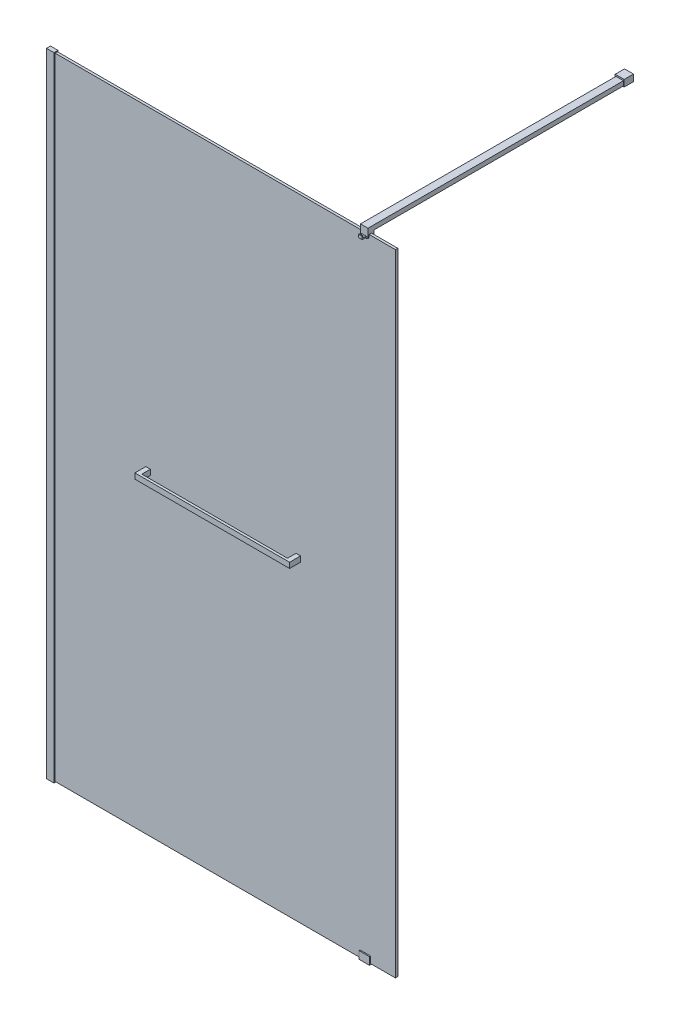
SolidWorks part; units mm, degrees
ref_plane "Płaszczyzna przednia" through (0, 0, 0) normal (0, 0, 1) x (1, 0, 0)
ref_plane "Płaszczyzna górna" through (0, 0, 0) normal (0, 1, 0) x (1, 0, 0)
ref_plane "Płaszczyzna prawa" through (0, 0, 0) normal (1, 0, 0) x (0, 0, -1)
sketch "Szkic1" plane through (0, 0, 0) normal (0, 1, 0) x (1, 0, 0)
  line L0 (0, 0) -> (0, 13.3)
  line L2 (0, 13.3) -> (25, 13.3)
  line L3 (25, 13.3) -> (25, 11.4)
  line L4 (25, 11.4) -> (11.45, 11.4)
  line L5 (11.45, 11.4) -> (11.45, 3.4)
  line L6 (11.45, 3.4) -> (25, 3.4)
  line L7 (25, 3.4) -> (25, 0)
  line L8 (25, 0) -> (0, 0)
  dimension "D1" = 13.3
  dimension "D4" = 1.9
  dimension "D5" = 8
  dimension "D6" = 3.4
  dimension "D7" = 13.55
  dimension "D8" = 25
extrude "Dodanie-wyciągnięcie1" add sketch "Szkic1" along normal blind 2100
sketch "Szkic2" plane through (0, 0, 0) normal (0, -1, 0) x (1, 0, 0)
  line L0 (11.45, -3.4) -> (1158.45, -3.4)
  line L1 (11.45, -3.4) -> (11.45, -11.4)
  line L2 (1158.45, -3.4) -> (1158.45, -11.4)
  line L3 (11.45, -11.4) -> (1158.45, -11.4)
  line L4 (11.45, -11.4) -> (25, -11.4) construction
  dimension "D1" = 1147
extrude "Dodanie-wyciągnięcie2" add sketch "Szkic2" against normal blind 2100 separate body
sketch "Szkic4" plane through (0, 2100, 0) normal (0, 1, 0) x (1, 0, 0)
  line L1 (25, 13.3) -> (0, 13.3) construction
  line L2 (25, 11.4) -> (25, 13.3) construction
  line L3 (0, 13.3) -> (0, 0) construction
  line L5 (0, 0) -> (25, 0) construction
  line L7 (25, 13.3) -> (0, 13.3)
  line L8 (25, 0) -> (25, 13.3)
  line L9 (0, 13.3) -> (0, 0)
  line L11 (0, 0) -> (25, 0)
extrude "Dodanie-wyciągnięcie3" add sketch "Szkic4" along normal blind 3
sketch "Szkic5" plane through (0, 0, 0) normal (0, -1, 0) x (1, 0, 0)
  line L1 (0, 0) -> (25, 0) construction
  line L2 (25, 0) -> (25, -3.4) construction
  line L3 (0, -13.3) -> (0, 0) construction
  line L5 (25, -13.3) -> (0, -13.3) construction
  line L7 (0, 0) -> (25, 0)
  line L8 (25, 0) -> (25, -13.3)
  line L9 (0, -13.3) -> (0, 0)
  line L11 (25, -13.3) -> (0, -13.3)
extrude "Dodanie-wyciągnięcie4" add sketch "Szkic5" along normal blind 3
ref_plane "Płaszczyzna1" through (1058.45, 0, 0) normal (1, 0, 0) x (0, 0, -1)
sketch "Szkic6" plane through (1058.45, 0, 0) normal (1, 0, 0) x (0, 0, -1)
  line L0 (11.4, 22) -> (15.75, 22)
  line L1 (15.75, 22) -> (15.75, -3)
  line L2 (15.75, -3) -> (-0.35, -3)
  line L3 (-0.35, -3) -> (-0.35, 22)
  line L4 (-0.35, 22) -> (3.4, 22)
  line L5 (11.4, 22) -> (11.4, 0)
  line L6 (11.4, 0) -> (11.4, 2100)
  line L7 (11.4, 0) -> (11.4, 2100) construction
  line L8 (3.4, 2100) -> (3.4, 0)
  line L9 (3.4, 2100) -> (3.4, 0) construction
  line L10 (11.4, 0) -> (3.4, 0)
  line L11 (3.4, 0) -> (3.4, 22)
  dimension "D1" = 4.35
  dimension "D2" = 25
  dimension "D3" = 3
  dimension "D4" = 3.75
extrude "Dodanie-wyciągnięcie5" add sketch "Szkic6" along normal mid plane 35 separate body
sketch "Szkic7" plane through (1058.45, 0, 0) normal (1, 0, 0) x (0, 0, -1)
  line L0 (3.4, 2100) -> (3.4, 0) construction
  line L1 (-0.6, 2120) -> (19.4, 2120)
  line L2 (3.4, 2100) -> (3.4, 0) construction
  line L4 (11.4, 2100) -> (3.4, 2100) construction
  line L13 (11.4, 2100) -> (11.4, 0) construction
  line L20 (19.4, 2120) -> (19.4, 2090)
  line L25 (19.4, 2090) -> (11.4, 2090)
  line L26 (11.4, 2090) -> (11.4, 2100)
  line L27 (11.4, 2100) -> (3.4, 2100)
  line L28 (3.4, 2100) -> (3.4, 2090)
  line L29 (3.4, 2090) -> (-13.37, 2090)
  line L30 (-13.37, 2090) -> (-13.37, 2100)
  line L31 (-13.37, 2100) -> (-10.37, 2100)
  line L32 (-10.37, 2100) -> (-9.8451, 2094)
  line L33 (-9.8451, 2094) -> (-0.6, 2094)
  line L34 (-0.6, 2094) -> (-0.6, 2120)
  dimension "D3" = 20
  dimension "D4" = 30
  dimension "D5" = 16.77
  dimension "D6" = 4
  dimension "D14" = 8
  dimension "D21" = 10
  dimension "D22" = 4
  dimension "D23" = 3
  dimension "D24" = 95
extrude "Dodanie-wyciągnięcie6" add sketch "Szkic7" along normal mid plane 25 separate body
sketch "Szkic8" plane through (0, 2100, 0) normal (0, 1, 0) x (1, 0, 0)
  line L0 (1045.95, -0.6) -> (1052.45, -3.631)
  line L1 (1052.45, -3.631) -> (1052.45, -13.37)
  line L2 (1070.95, -0.6) -> (1064.45, -3.631)
  line L3 (1064.45, -3.631) -> (1064.45, -13.37)
  line L4 (1058.45, -10.37) -> (1058.45, 156.6902) construction
  line L5 (1070.95, -10.37) -> (1045.95, -10.37) construction
  line L6 (1052.45, -13.37) -> (1064.45, -13.37)
  line L7 (1070.95, -13.37) -> (1045.95, -13.37) construction
  dimension "D1" = 12
  dimension "D2" = 115
extrude "Wytnij-wyciągnięcie1" cut sketch "Szkic8" against normal through all and the other way through all
sketch "Szkic10" plane through (0, 2120, 0) normal (0, 1, 0) x (1, 0, 0)
  line L0 (1058.45, 31.9) -> (1058.45, 19.4) construction
  line L1 (1045.95, 881.03) -> (1070.95, 881.03)
  line L2 (1045.95, 881.03) -> (1045.95, 19.4)
  line L3 (1045.95, 19.4) -> (1070.95, 19.4)
  line L4 (1070.95, 19.4) -> (1045.95, 19.4) construction
  line L5 (1045.95, 19.4) -> (1045.95, -0.6) construction
  line L6 (1070.95, 881.03) -> (1070.95, 19.4)
  point P4 (1058.45, 31.9)
  dimension "D2" = 861.63
  dimension "D1" = 25
  dimension "D3" = 12.5
extrude "Dodanie-wyciągnięcie7" add sketch "Szkic10" against normal blind 15
sketch "Szkic14" plane through (0, 0, -881.03) normal (0, 0, -1) x (-1, 0, 0)
  line L1 (-1073.45, 2125) -> (-1043.45, 2125)
  line L2 (-1073.45, 2125) -> (-1073.45, 2103)
  line L3 (-1073.45, 2103) -> (-1043.45, 2103)
  line L4 (-1043.45, 2125) -> (-1043.45, 2103)
  line L5 (-1073.45, 2125) -> (-1043.45, 2103) construction
  line L6 (-1073.45, 2103) -> (-1043.45, 2125) construction
  line L7 (-1058.45, 2120) -> (-1058.45, 2114) construction
  line L8 (-1070.95, 2120) -> (-1045.95, 2120) construction
  line L9 (-1070.95, 2105) -> (-1045.95, 2105) construction
  point P0 (-1058.45, 2114)
  dimension "D1" = 30
  dimension "D2" = 22
  dimension "D3" = 2
extrude "Dodanie-wyciągnięcie8" add sketch "Szkic14" against normal blind 31
sketch "Szkic17" plane through (0, 0, -3.4) normal (0, 0, 1) x (1, 0, 0)
  line L0 (584.95, 2100) -> (584.95, 1050) construction
  line L1 (1158.45, 2100) -> (11.45, 2100) construction
  line L2 (584.95, 1050) -> (584.95, 0) construction
  line L3 (1158.45, 0) -> (11.45, 0) construction
  line L4 (334.95, 1050) -> (834.95, 1050) construction
  line L6 (327.45, 1059) -> (342.45, 1059)
  line L7 (327.45, 1059) -> (327.45, 1041)
  line L8 (327.45, 1041) -> (342.45, 1041)
  line L9 (342.45, 1059) -> (342.45, 1041)
  line L10 (327.45, 1059) -> (342.45, 1041) construction
  line L11 (327.45, 1041) -> (342.45, 1059) construction
  line L12 (827.45, 1059) -> (842.45, 1059)
  line L13 (827.45, 1059) -> (827.45, 1041)
  line L14 (827.45, 1041) -> (842.45, 1041)
  line L15 (842.45, 1059) -> (842.45, 1041)
  line L16 (827.45, 1059) -> (842.45, 1041) construction
  line L17 (827.45, 1041) -> (842.45, 1059) construction
  dimension "D1" = 500
  dimension "D2" = 15
  dimension "D3" = 18
extrude "polka_1a" add sketch "Szkic17" along normal blind 36.5 and the other way blind 31 separate body
sketch "Szkic18" plane through (327.45, 0, 0) normal (-1, 0, 0) x (0, 0, 1)
  line L0 (-34.4, 1059) -> (-34.4, 1041) construction
  line L1 (-34.4, 1053.73) -> (-21.6, 1053.73)
  line L2 (-34.4, 1053.73) -> (-34.4, 1045.73)
  line L3 (-34.4, 1045.73) -> (-21.6, 1045.73)
  line L4 (-21.6, 1053.73) -> (-21.6, 1045.73)
  line L5 (-34.4, 1041) -> (33.1, 1041) construction
  dimension "D1" = 4.73
  dimension "D2" = 8
  dimension "D3" = 12.8
extrude "polka_1b" cut sketch "Szkic18" against normal up to surface (515 mm away)
sketch "Szkic19" plane through (0, 1059, 0) normal (0, 1, 0) x (1, 0, 0)
  line L0 (842.45, 21.6) -> (327.45, 21.6)
  line L1 (842.45, 21.6) -> (842.45, 101.6)
  line L2 (327.45, 21.6) -> (327.45, 101.6)
  line L3 (842.45, 101.6) -> (327.45, 101.6)
  line L4 (842.45, 34.4) -> (842.45, -33.1) construction
  line L5 (327.45, 34.4) -> (327.45, -33.1) construction
  line L6 (11.45, 11.4) -> (1158.45, 11.4) construction
  dimension "D1" = 10.2
  dimension "D2" = 80
extrude "polka_1c" add sketch "Szkic19" against normal blind 8 from offset 5.28 separate body
sketch "Szkic20" plane through (342.45, 0, 0) normal (1, 0, 0) x (0, 0, -1)
  line L0 (34.4, 1041) -> (-33.1, 1041) construction
  line L1 (-33.1, 1059) -> (-25.1, 1059)
  line L2 (-33.1, 1059) -> (-33.1, 1041)
  line L3 (-33.1, 1041) -> (-25.1, 1041)
  line L4 (-25.1, 1059) -> (-25.1, 1041)
  dimension "D1" = 8
extrude "polka_1d" add sketch "Szkic20" along normal up to surface (485 mm away)
